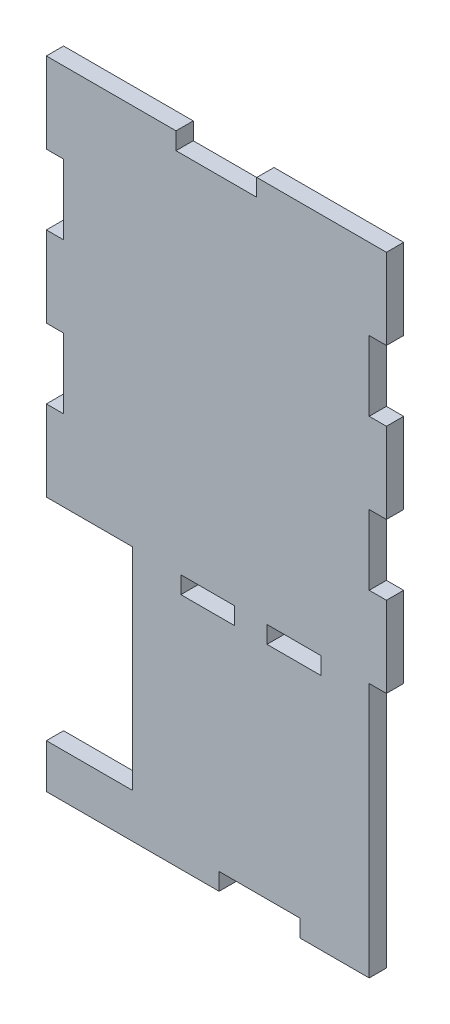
SolidWorks part; units mm, degrees
ref_plane "Front Plane" through (0, 0, 0) normal (0, 0, 1) x (1, 0, 0)
ref_plane "Top Plane" through (0, 0, 0) normal (0, 1, 0) x (1, 0, 0)
ref_plane "Right Plane" through (0, 0, 0) normal (1, 0, 0) x (0, 0, -1)
sketch "Sketch2" plane through (0, 0, 0) normal (0, 0, 1) x (1, 0, 0)
  line L0 (204, 180) -> (204, 103)
  line L1 (-96, 460) -> (-96, 535)
  line L2 (-96, 180) -> (-16, 180)
  line L3 (220, 535) -> (99.5, 535)
  line L4 (204, 103) -> (204, -37)
  line L5 (-16, 180) -> (-16, -16)
  line L6 (220, 460) -> (204, 460)
  line L7 (220, 320) -> (220, 395)
  line L8 (220, 395) -> (204, 395)
  line L9 (204, 460) -> (204, 395)
  line L10 (64.5, -57) -> (64.5, -41)
  line L11 (220, 320) -> (204, 320)
  line L12 (220, 180) -> (220, 255)
  line L13 (220, 255) -> (204, 255)
  line L14 (204, 320) -> (204, 255)
  line L15 (-30.5002, -57) -> (-30.5002, 20) construction
  line L16 (220, 180) -> (204, 180)
  line L17 (-96, -57) -> (-96, -16)
  line L18 (-96, -16) -> (-16, -16)
  line L20 (204, -37) -> (204, -57)
  line L21 (64.5, -57) -> (139.5, -57)
  line L22 (29, 164) -> (-209.8235, 164) construction
  line L27 (29, 180) -> (29, 164)
  line L28 (109, 180) -> (159, 180)
  line L29 (139.5, -57) -> (139.5, -41)
  line L30 (220, 460) -> (220, 535)
  line L31 (-80, 320) -> (-80, 255)
  line L32 (-96, 255) -> (-80, 255)
  line L33 (-96, 180) -> (-96, 255)
  line L34 (-96, 320) -> (-80, 320)
  line L35 (-80, 460) -> (-80, 395)
  line L36 (-96, 395) -> (-80, 395)
  line L37 (-96, 320) -> (-96, 395)
  line L38 (-96, 460) -> (-80, 460)
  line L39 (109, 180) -> (109, 164)
  line L40 (109, 164) -> (159, 164)
  line L41 (159, 180) -> (159, 164)
  line L42 (79, 164) -> (29, 164)
  line L43 (79, 180) -> (79, 164)
  line L44 (79, 180) -> (29, 180)
  line L45 (-96, -57) -> (204, -57)
  line L46 (24.5, 535) -> (-96, 535)
  line L52 (64.5, -41) -> (139.5, -41)
  line L54 (24.5, 535) -> (24.5, 519)
  line L55 (24.5, 519) -> (99.5, 519)
  line L56 (99.5, 535) -> (99.5, 519)
extrude "Boss-Extrude2" add sketch "Sketch2" along normal blind 16
equation "\"thk\"= 16mm"
equation "\"D4@Sketch2\"=\"thk\""
equation "\"D7@Sketch2\"=\"thk\""
equation "\"D10@Sketch2\"=\"thk\""
equation "\"D1@Boss-Extrude2\"=\"thk\""
equation "\"D22@Sketch2\"=\"thk\""
equation "\"D23@Sketch2\"=\"thk\""
equation "\"D24@Sketch2\"=\"thk\""
equation "\"D25@Sketch2\"=\"thk\""
equation "\"D28@Sketch2\"=\"thk\""
equation "\"D32@Sketch2\"=\"thk\""
equation "\"D39@Sketch2\"=\"thk\""
